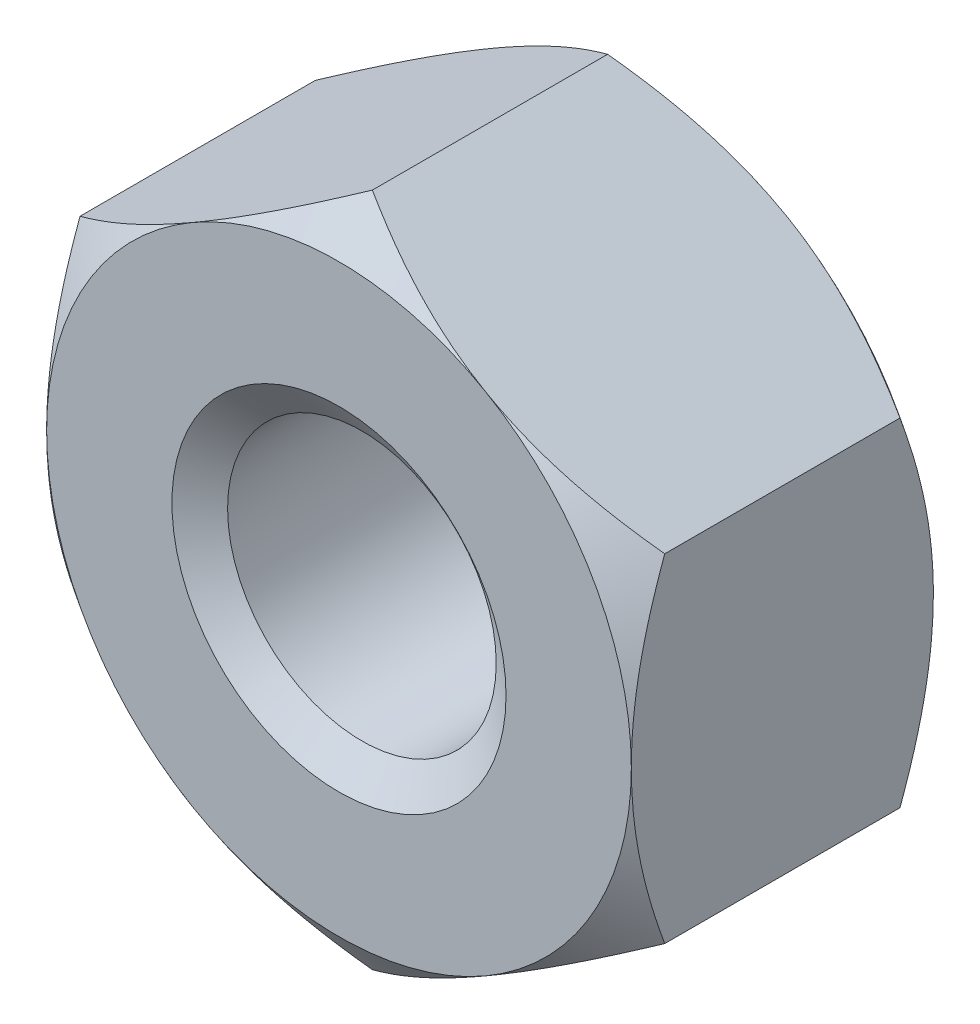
SolidWorks part; units mm, degrees
extrude "BaseNut" add sketch "BaseNutSke" against normal blind 5.7404
sketch "BaseNutSke" plane through (0, 0, 0) normal (0, 0, 1) x (1, 0, 0)
  line L6 (5.5563, 3.2079) -> (5.5563, -3.2079)
  line L7 (-5.5562, 3.2079) -> (-5.5562, -3.2079)
  line L8 (5.5563, 3.2079) -> (0, 6.4158)
  line L9 (0, 6.4158) -> (-5.5562, 3.2079)
  line L10 (-5.5562, -3.2079) -> (0, -6.4158)
  line L11 (0, -6.4158) -> (5.5563, -3.2079)
  circle A0 centre (0, 0) radius 2.5527
pattern_linear "ThdSchPat" [suppressed]
revolve "ThreadSchematic" cut sketch "ThdSchSke" angle 360 about L6
sketch "ThdSchSke" plane through (0, 0, 0) normal (0, 1, 0) x (1, 0, 0)
  line L0 (-3.175, 0.0254) -> (-2.5527, 0.4611)
  line L1 (-2.5527, 0.4611) -> (-1.2763, 0.4611)
  line L2 (-1.2763, 0.4611) -> (-1.2763, -0.4103)
  line L3 (-1.2763, -0.4103) -> (-2.5527, -0.4103)
  line L4 (-2.5527, -0.4103) -> (-3.175, 0.0254)
  line L5 (-3.175, 0.9068) -> (3.175, 0.9068) construction
  line L6 (0, 0.9068) -> (0, -2.9874) construction
  line L7 (0, 5.2793) -> (0, 0.4357) construction
ref_plane "Plane1" through (0, 0, 0) normal (0, 0, 1) x (1, 0, 0)
ref_plane "Plane2" through (0, 0, 0) normal (0, 1, 0) x (1, 0, 0)
ref_plane "Plane3" through (0, 0, 0) normal (1, 0, 0) x (0, 0, -1)
other "Configuration Table"
sketch "Sketch4" plane through (0, 0, 0) normal (1, 0, 0) x (0, 0, -1)
  line L0 (5.7404, 5.5562) -> (5.334, 5.5563)
  line L1 (5.7404, 5.5562) -> (5.7404, 19.1158)
  line L2 (5.334, 19.1158) -> (5.7404, 19.1158)
  line L3 (5.334, 19.1158) -> (5.334, 5.5563)
  line L4 (0, 0) -> (34.925, 0) construction
  line L6 (5.7404, 3.2079) -> (5.7404, 6.4158) construction
  line L7 (0, 5.5562) -> (-12.7, 5.5562)
  line L8 (0, 3.2079) -> (0, 6.4158) construction
  line L9 (0.635, 6.4158) -> (0.635, 19.1158)
  line L10 (0.635, 19.1158) -> (-12.7, 19.1158)
  line L11 (-12.7, 19.1158) -> (-12.7, 5.5562)
  line L12 (0, 5.5562) -> (0.635, 6.4158)
  line L14 (0, 3.2079) -> (0, -3.2079) construction
  line L15 (5.7404, 6.4158) -> (0, 6.4158) construction
revolve "Bearing-Face" [suppressed] cut sketch "Sketch4" angle 360 about L4
sketch "Sketch3" plane through (0, 0, 0) normal (1, 0, 0) x (0, 0, -1)
  line L0 (5.7404, 5.5562) -> (5.1054, 6.4158)
  line L1 (5.1054, 6.4158) -> (5.1054, 19.1158)
  line L2 (5.1054, 19.1158) -> (18.4404, 19.1158)
  line L3 (18.4404, 19.1158) -> (18.4404, 5.5563)
  line L4 (18.4404, 5.5563) -> (5.7404, 5.5562)
  line L5 (5.7404, 3.2079) -> (5.7404, 6.4158) construction
  line L6 (5.7404, 6.4158) -> (0, 6.4158) construction
  line L7 (0, 0) -> (38.6776, 0) construction
  line L8 (5.7404, 0) -> (0, 0) construction
  line L9 (2.8702, 6.4158) -> (2.8702, 44.222) construction
  line L10 (0.635, 19.1158) -> (-12.7, 19.1158)
  line L11 (-12.7, 19.1158) -> (-12.7, 5.5563)
  line L12 (-12.7, 5.5563) -> (0, 5.5562)
  line L13 (0, 5.5562) -> (0.635, 6.4158)
  line L14 (0.635, 6.4158) -> (0.635, 19.1158)
  line L16 (5.7404, 6.4158) -> (0, 6.4158) construction
revolve "Double-Chamfer" cut sketch "Sketch3" angle 360 about L7
sketch "Sketch5" plane through (0, 0, 0) normal (1, 0, 0) x (0, 0, -1)
  line L0 (5.715, 3.175) -> (5.2357, 2.4905)
  line L1 (5.7658, 3.175) -> (5.715, 3.175)
  line L2 (5.7658, 3.175) -> (5.7658, 2.4905)
  line L3 (5.7658, 2.4905) -> (5.2357, 2.4905)
  line L6 (-0.0508, 3.175) -> (0, 3.175)
  line L7 (0, 3.175) -> (0.4793, 2.4905)
  line L9 (0.4793, 2.4905) -> (-0.0508, 2.4905)
  line L10 (-0.0508, 2.4905) -> (-0.0508, 3.175)
  line L11 (25.0375, 0) -> (38.388, 0) construction
  line L12 (5.7404, 0) -> (0, 0) construction
revolve "EndChamfer" cut sketch "Sketch5" angle 360 about L11
equation "\"D2@BaseNutSke\" = \"Width_flats@BaseNutSke\" / 2"
equation "\"D3@BaseNutSke\" = \"Width_flats@BaseNutSke\" / 2"
equation "\"D1@Sketch3\" = \"Width_flats@BaseNutSke\" /2"
equation "\"D2@Sketch3\" = \"Thread_major@ThreadCosmetic\" *.1"
equation "\"D1@Sketch4\" = \"D2@BaseNutSke\""
equation "\"D2@Sketch4\" = \"Thread_major@ThreadCosmetic\" *.10"
equation "\"D4@BaseNutSke\" = \"D3@BaseNutSke\""
equation "\"Thread_major@ThdSchSke\" = \"Thread_major@ThreadCosmetic\""
equation "\"Tap_Drill@ThdSchSke\" = \"Tap_drill@BaseNutSke\""
equation "\"OverCut@ThdSchSke\" = \"Tap_Drill@ThdSchSke\" * 0.5"
equation "\"Num_threads@ThdSchPat\" = int(  ( \"Thickness@BaseNut\" - 0.002 ) / \"Advance@ThdSchSke\" + 0.999 )  + 1"
equation "\"Advance@ThdSchPat\" = ( \"Thickness@BaseNut\" - 0.002 ) /  (\"Num_threads@ThdSchPat\" - 1) 'relax it"
equation "' \"Num_threads@ThdSchPat\" = \"Num_threads@ThdSchPat\" - sgn( \"Num_threads@ThdSchPat\" - 1) '---chamfered tips only---"
equation "\"ThreadMajor@Sketch5\" = \"Thread_major@ThreadCosmetic\" * 0.5"
equation "\"ChamferDepth@Sketch5\" = (\"Thread_major@ThreadCosmetic\" - \"Tap_drill@BaseNutSke\") * 0.55"
equation "\"Offset1@Sketch5\" = \"Thickness@BaseNut\" + 0.001"
equation "\"Offset2@Sketch5\" = \"Offset1@Sketch5\" + 0.002"
